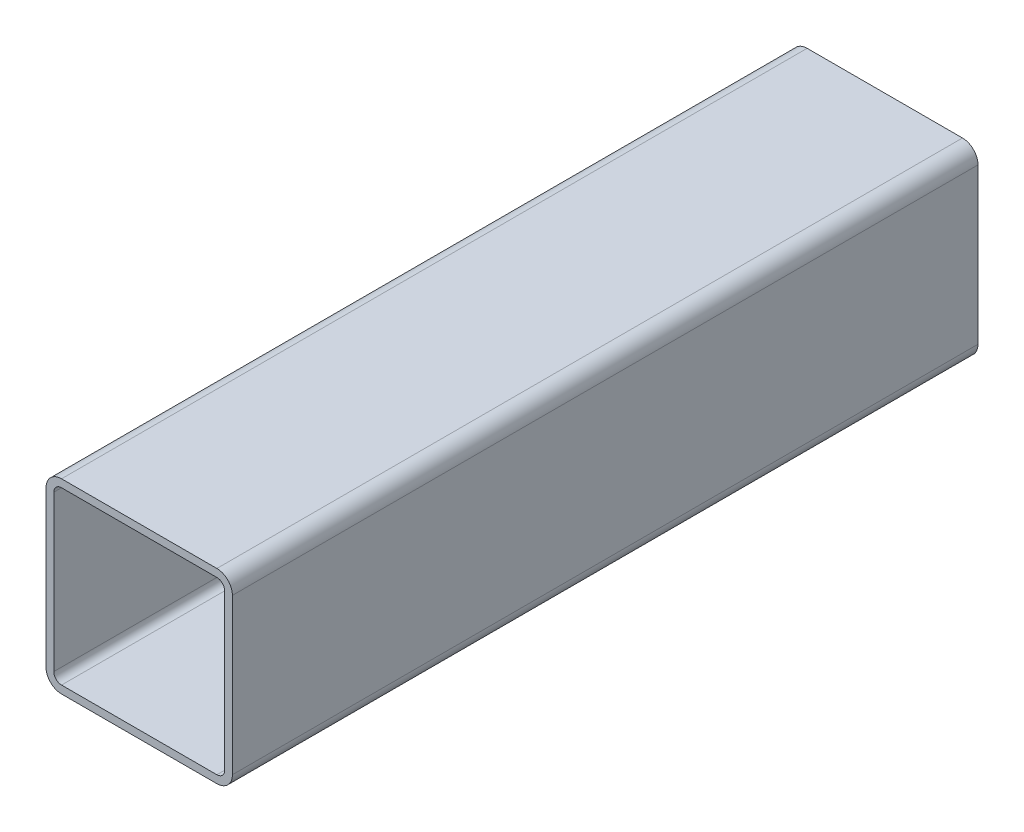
SolidWorks part; units mm, degrees
ref_plane "Front Plane" through (0, 0, 0) normal (0, 0, 1) x (1, 0, 0)
ref_plane "Top Plane" through (0, 0, 0) normal (0, 1, 0) x (1, 0, 0)
ref_plane "Right Plane" through (0, 0, 0) normal (1, 0, 0) x (0, 0, -1)
sketch "Sketch1" plane through (0, 0, 0) normal (0, 0, 1) x (1, 0, 0)
sketch_block_instance "HSS3x3x0.125-1"
sketch_block "HSS3x3x0.125"
extrude "Boss-Extrude1" add sketch "Sketch1" along normal blind 304.8
